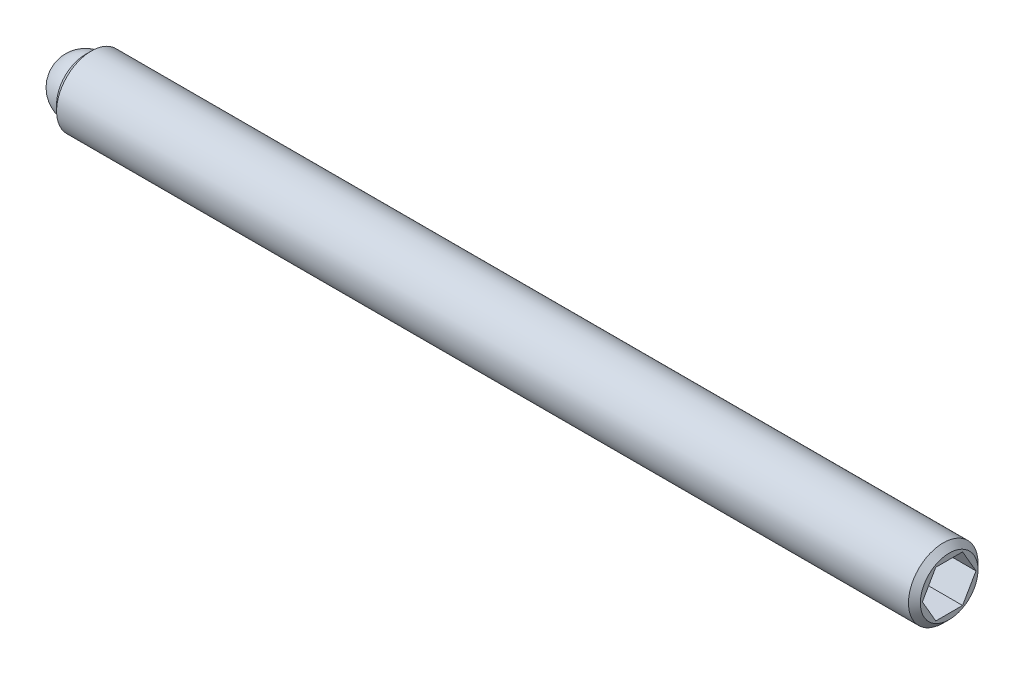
SolidWorks part; units mm, degrees
ref_plane "Front Plane" through (0, 0, 0) normal (0, 0, 1) x (1, 0, 0)
ref_plane "Top Plane" through (0, 0, 0) normal (0, 1, 0) x (1, 0, 0)
ref_plane "Right Plane" through (0, 0, 0) normal (1, 0, 0) x (0, 0, -1)
sketch "Sketch2" plane through (0, 0, 0) normal (1, 0, 0) x (0, 0, -1)
  circle A0 centre (0, 0) radius 1.4859
  dimension "D1" = 2.9718
extrude "Boss-Extrude1" add sketch "Sketch2" along normal blind 36.9094
sketch "Sketch3" plane through (0, 0, 0) normal (-1, 0, 0) x (0, 0, 1)
  circle A0 centre (0, 0) radius 1.1906
  dimension "D1" = 2.3813
chamfer "Chamfer1" distance 0.254 angle 45 1 edges at (0, 0, -1.4859)
chamfer "Chamfer2" distance 0.254 angle 45 1 edges at (36.9094, 0, -1.4859)
sketch "Sketch4" plane through (36.9094, 0, 0) normal (1, 0, 0) x (0, 0, -1)
  line L1 (1.1457, 0) -> (0.5728, 0.9922)
  line L2 (0.5728, 0.9922) -> (-0.5728, 0.9922)
  line L3 (-0.5728, 0.9922) -> (-1.1457, 0)
  line L4 (-1.1457, 0) -> (-0.5728, -0.9922)
  line L5 (-0.5728, -0.9922) -> (0.5728, -0.9922)
  line L6 (0.5728, -0.9922) -> (1.1457, 0)
  circle A0 centre (0, 0) radius 0.9922 construction
extrude "Cut-Extrude2" cut sketch "Sketch4" against normal blind 2.286
extrude "Cut-Extrude3" cut sketch "Sketch3" against normal blind 1.1906
sketch "Sketch5" plane through (0, 0, 0) normal (-1, 0, 0) x (0, 0, 1)
  line L0 (0, 0) -> (0, -1.1906)
  line L1 (0, 0) -> (0, 1.1906)
  arc A0 (0, 1.1906) -> (0, -1.1906) centre (0, 0) ccw
  dimension "D1" = 1.1906
revolve "Revolve1" add sketch "Sketch5" angle 360 about L1
